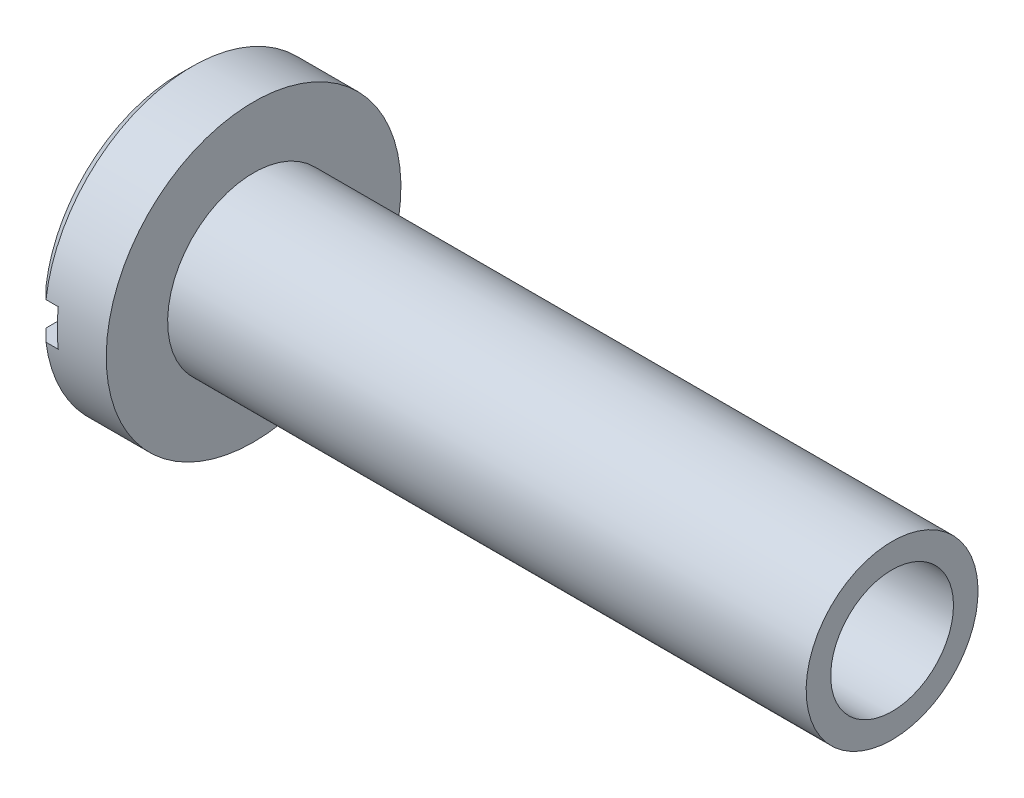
SolidWorks part; units mm, degrees
ref_plane "Front" through (0, 0, 0) normal (0, 0, 1) x (1, 0, 0)
ref_plane "Top" through (0, 0, 0) normal (0, 1, 0) x (1, 0, 0)
ref_plane "Right" through (0, 0, 0) normal (1, 0, 0) x (0, 0, -1)
sketch "Sketch1" plane through (0, 0, 0) normal (0, 0, 1) x (1, 0, 0)
  line L0 (0, 0) -> (14.5, 0) construction
  line L1 (0, 0) -> (0, 3)
  line L2 (0, 3) -> (1.5, 3)
  line L3 (1.5, 3) -> (1.5, 1.75)
  line L4 (1.5, 1.75) -> (14.5, 1.75)
  line L5 (14.5, 1.75) -> (14.5, 0)
  line L6 (14.5, 0) -> (0, 0)
  dimension "D1" = 14.5
  dimension "D2" = 1.75
  dimension "D3" = 3
  dimension "D4" = 1.5
revolve "Base-Revolve" add sketch "Sketch1" angle 360 about L0
hole_wizard "M2.5x0.45 Tapped Hole1" positions "Sketch3" profile "Sketch2" tap size "M2.5x0.45" standard "Ansi Metric"
sketch "Sketch3" plane through (14.5, 0, 0) normal (1, 0, 0) x (0, 0, -1)
  point P0 (0, 0)
sketch "Sketch2" plane through (14.5, 0, 0) normal (0, 1, 0) x (0, 0, -1)
  line L0 (0, 0) -> (0, 7.9659)
  line L1 (0, 7.9659) -> (1.025, 7.35)
  line L2 (1.025, 7.35) -> (1.025, 6)
  line L3 (1.025, 6) -> (1.25, 6)
  line L4 (1.25, 6) -> (1.25, 0)
  line L5 (1.25, 0) -> (0, 0)
  line L10 (0, 7.9659) -> (-1.025, 7.35) construction
  line L11 (0, -6.35) -> (0, 107.95) construction
  dimension "Tap Drill Dia." = 2.05
  dimension "Tap Drill Depth" = 7.35
  dimension "Thread Major Dia." = 2.5
  dimension "Thread Depth" = 6
  dimension "Drill Angle" = 118
sketch "Sketch4" plane through (0, 0, 0) normal (0, 0, 1) x (1, 0, 0)
  line L0 (0, 3) -> (0, -3) construction
  line L1 (0, 0.375) -> (0.5, 0.375)
  line L2 (0, 0.375) -> (0, -0.375)
  line L3 (0, -0.375) -> (0.5, -0.375)
  line L4 (0.5, 0.375) -> (0.5, -0.375)
  line L5 (0, 0) -> (0.5, 0) construction
  dimension "D1" = 0.75
  dimension "D2" = 0.5
extrude "Cut-Extrude1" cut sketch "Sketch4" against normal through all and the other way through all
chamfer "Chamfer1" distance 0.25 angle 45 2 edges at (0, 3, 0) (0, -3, 0)
